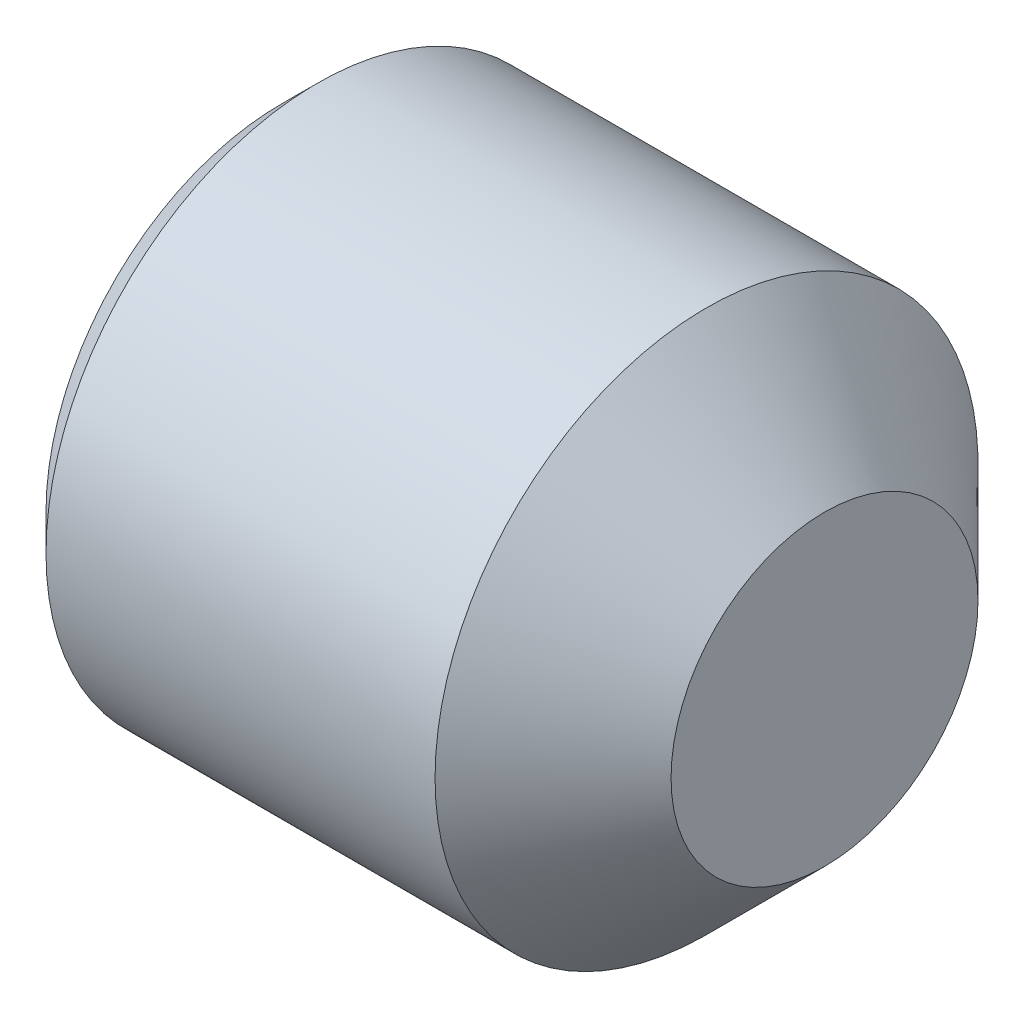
SolidWorks part; units mm, degrees
ref_plane "Plane1" through (0, 0, 0) normal (0, 0, 1) x (1, 0, 0)
ref_plane "Plane2" through (0, 0, 0) normal (0, 1, 0) x (1, 0, 0)
ref_plane "Plane3" through (0, 0, 0) normal (1, 0, 0) x (0, 0, -1)
sketch "BodySke" plane through (0, 0, 0) normal (0, 0, 1) x (1, 0, 0)
  line L0 (0, 0) -> (0, 4.1326)
  line L1 (0, 4.1326) -> (0.6299, 4.7625)
  line L2 (0.6299, 4.7625) -> (7.4549, 4.7625)
  line L3 (7.4549, 4.7625) -> (9.525, 2.6924)
  line L4 (9.525, 0) -> (0, 0)
  line L5 (-12.7, 0) -> (88.9, 0) construction
  line L6 (9.525, 2.6924) -> (9.525, 0)
  line L7 (9.525, 2.6924) -> (9.525, 12.2174) construction
  line L8 (0, -4.1326) -> (0.6299, -4.7625) construction
  line L9 (1.0592, 15.875) -> (1.0592, -3.175) construction
  line L10 (7.4549, -4.7625) -> (9.525, -2.6924) construction
  dimension "Length" = 9.525
  dimension "Diameter" = 9.525
  dimension "Drive_ch_ang" = 45
  dimension "Minor_dia" = 8.2652
  dimension "Cup_nose_ang" = 45
  dimension "Cup_dia" = 5.3848
  dimension "Advance" = 1.0592
revolve "BaseBody" add sketch "BodySke" angle 360 about L5
sketch "Sketch2" plane through (0, 0, 0) normal (-1, 0, 0) x (0, 0, 1)
  line L0 (1.3748, 2.3813) -> (-1.3748, 2.3813)
  line L1 (-1.3748, 2.3813) -> (-2.7496, 0)
  line L2 (1.3748, 2.3813) -> (2.7496, 0)
  line L3 (1.3748, -2.3812) -> (2.7496, 0)
  line L4 (1.3748, -2.3812) -> (-1.3748, -2.3812)
  line L5 (-1.3748, -2.3812) -> (-2.7496, 0)
  dimension "Hex_size" = 4.7625
  dimension "D2" = 2.3813
  dimension "D3" = 2.3813
extrude "Hex" cut sketch "Sketch2" against normal blind 4.7752
sketch "Sketch4" plane through (0, 4.7709, -0.5249) normal (-1, 0, 0) x (0, 0, 1)
  line L0 (0.5249, -4.7709) -> (3.3316, -4.7709)
  line L1 (0.5249, -4.7709) -> (6.6732, -1.2211) construction
  line L2 (0.5249, -4.7709) -> (1.9282, -2.3402)
  line L3 (2.8584, -4.1568) -> (3.21, -3.9538)
  line L4 (2.2234, -3.057) -> (2.575, -2.854)
  arc A0 (2.8584, -4.1568) -> (2.2234, -3.057) centre (0.5249, -4.7709) ccw
  arc A1 (3.3316, -4.7709) -> (3.21, -3.9538) centre (0.5249, -4.7709) ccw
  arc A2 (1.9282, -2.3402) -> (2.575, -2.854) centre (0.5249, -4.7709) cw
  circle A3 centre (0.5249, -4.7709) radius 2.413 construction
  circle A4 centre (0.5249, -4.7709) radius 2.8067 construction
  dimension "D1" = 30
  dimension "Spline_n_dim" = 4.826
  dimension "Spline_m_dim" = 5.6134
  dimension "Spline_a_dim" = 60
  dimension "D3" = 0.635
  dimension "Spline_p_dim" = 1.27
extrude "Spline" [suppressed] cut sketch "Sketch4" against normal blind 4.7752
pattern_circular "CirPattern1" [suppressed] count 6 every 60 about axis through (-12.7, 0, 0) along (1, 0, 0)
sketch "ThdSchSke" plane through (0, 0, 0) normal (0, 0, 1) x (1, 0, 0)
  line L0 (0.6299, -4.1326) -> (0.1888, -4.7625)
  line L1 (0.6299, -4.1326) -> (1.071, -4.7625)
  line L2 (1.071, -4.7625) -> (1.071, -5.9531)
  line L3 (-3.175, 0) -> (5.1513, 0) construction
  line L4 (0.6299, 4.7625) -> (0.6299, -4.7625) construction
  line L5 (1.071, -5.9531) -> (0.1888, -5.9531)
  line L6 (0.1888, -5.9531) -> (0.1888, -4.7625)
  dimension "Thread_minor" = 8.2652
  dimension "Diameter" = 9.525
  dimension "SideAngle" = 55
  dimension "VeeAngle" = 70
  dimension "Overcut" = 11.9063
revolve "ThreadSchematic" [suppressed] cut sketch "ThdSchSke" angle 360 about L3
pattern_linear "ThdSchPat" [suppressed]
equation "\"D2@Sketch2\" = \"Hex_size@Sketch2\" / 2"
equation "\"D3@Sketch2\" = \"Hex_size@Sketch2\" / 2"
equation "\"Thread_minor@ThreadCosmetic\" = \"Minor_dia@BodySke\""
equation "\"D1@Sketch4\" = \"Spline_a_dim@Sketch4\" / 2"
equation "\"D3@Sketch4\" = \"Spline_p_dim@Sketch4\" / 2"
equation "\"D2@CirPattern1\" = \"Spline_a_dim@Sketch4\""
equation "\"Num_teeth@CirPattern1\" = 360 / \"D2@CirPattern1\""
equation "\"Thread_minor@ThdSchSke\" = \"Thread_minor@ThreadCosmetic\""
equation "\"Diameter@ThdSchSke\" = \"Diameter@BodySke\""
equation "\"Overcut@ThdSchSke\" = \"Diameter@BodySke\" * 1.25"
equation "\"Num_threads@ThdSchPat\" = int( (\"Length@BodySke\" - ( ( ( \"Diameter@BodySke\" - \"Minor_dia@BodySke\" ) * 0.5 ) / tan( \"Drive_ch_ang@BodySke\" * 0.017453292 ) ) - ( ( ( \"Diameter@BodySke\" - \"Cup_dia@BodySk"
equation "\"Advance@ThdSchPat\" = (\"Length@BodySke\" - ( ( ( \"Diameter@BodySke\" - \"Minor_dia@BodySke\" ) * 0.5 ) / tan( \"Drive_ch_ang@BodySke\" * 0.017453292 ) ) - ( ( ( \"Diameter@BodySke\" - \"Cup_dia@BodySke\" ) * 0."
equation "' \"Num_threads@ThdSchPat\" = \"Num_threads@ThdSchPat\" - sgn( \"Num_threads@ThdSchPat\" - 1) '---chamfered tips only---"
